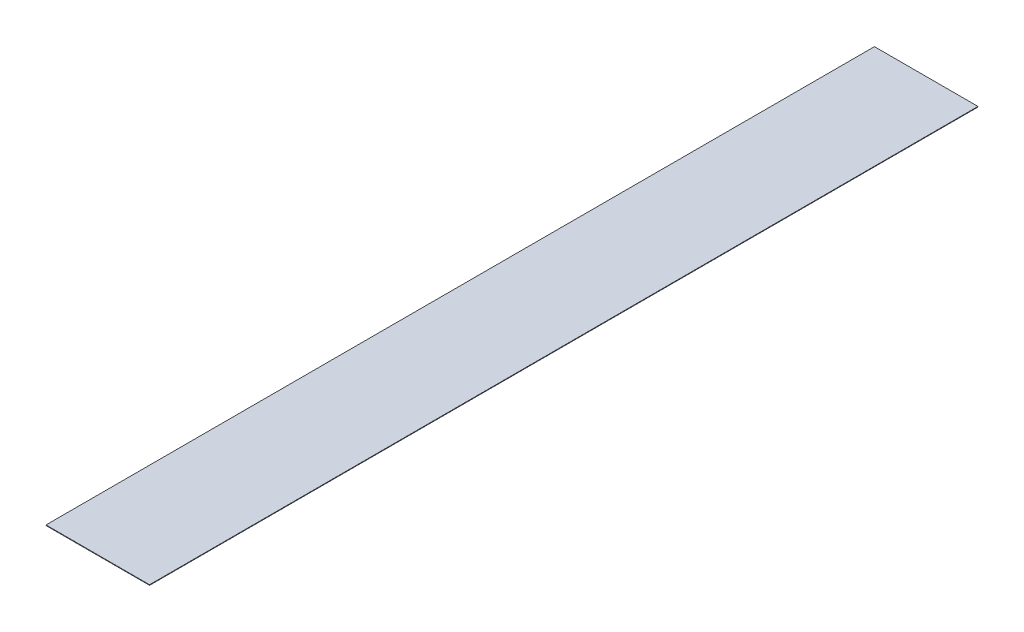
SolidWorks part; units mm, degrees
ref_plane "Front Plane" through (0, 0, 0) normal (0, 0, 1) x (1, 0, 0)
ref_plane "Top Plane" through (0, 0, 0) normal (0, 1, 0) x (1, 0, 0)
ref_plane "Right Plane" through (0, 0, 0) normal (1, 0, 0) x (0, 0, -1)
sketch "Sketch1" plane through (0, 0, 0) normal (0, 1, 0) x (1, 0, 0)
  line L0 (-47.625, 0) -> (0, 0)
  line L2 (0, 0) -> (0, -381)
  line L3 (0, -381) -> (-47.625, -381)
  line L4 (-47.625, 0) -> (-47.625, -381)
  dimension "D1" = 381
  dimension "D2" = 47.625
extrude "Boss-Extrude1" add sketch "Sketch1" along normal blind 0.254
